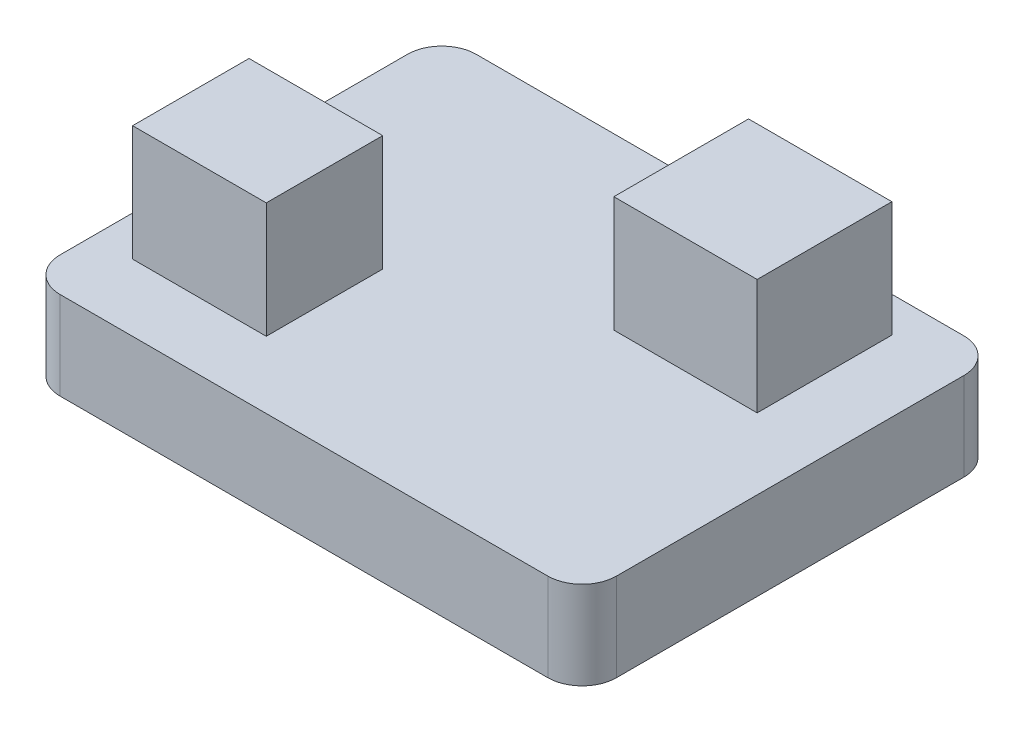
SolidWorks part; units mm, degrees
ref_plane "Front Plane" through (0, 0, 0) normal (0, 0, 1) x (1, 0, 0)
ref_plane "Top Plane" through (0, 0, 0) normal (0, 1, 0) x (1, 0, 0)
ref_plane "Right Plane" through (0, 0, 0) normal (1, 0, 0) x (0, 0, -1)
sketch "Sketch1" plane through (0, 0, 0) normal (0, 1, 0) x (1, 0, 0)
  line L1 (-102.7339, 76.8271) -> (102.7339, 76.8271)
  line L2 (-102.7339, 76.8271) -> (-102.7339, -76.8271)
  line L3 (-102.7339, -76.8271) -> (102.7339, -76.8271)
  line L4 (102.7339, 76.8271) -> (102.7339, -76.8271)
  line L5 (-102.7339, 76.8271) -> (102.7339, -76.8271) construction
  line L6 (-102.7339, -76.8271) -> (102.7339, 76.8271) construction
  point P0 (0, 0)
extrude "Extrude1" add sketch "Sketch1" along normal blind 32.512
sketch "Sketch2" plane through (0, 32.512, 0) normal (0, 1, 0) x (1, 0, 0)
  line L1 (-87.986, -9.1262) -> (-38.6203, -9.1262)
  line L2 (-87.986, -9.1262) -> (-87.986, -52.1292)
  line L3 (-87.986, -52.1292) -> (-38.6203, -52.1292)
  line L4 (-38.6203, -9.1262) -> (-38.6203, -52.1292)
  line L5 (-87.986, -9.1262) -> (-38.6203, -52.1292) construction
  line L6 (-87.986, -52.1292) -> (-38.6203, -9.1262) construction
  line L7 (23.5842, 63.7742) -> (76.5126, 63.7742)
  line L8 (23.5842, 63.7742) -> (23.5842, 14.0196)
  line L9 (23.5842, 14.0196) -> (76.5126, 14.0196)
  line L10 (76.5126, 63.7742) -> (76.5126, 14.0196)
  line L11 (23.5842, 63.7742) -> (76.5126, 14.0196) construction
  line L12 (23.5842, 14.0196) -> (76.5126, 63.7742) construction
  point P0 (-63.3032, -30.6277)
  point P5 (50.0484, 38.8969)
extrude "Extrude2" add sketch "Sketch2" along normal blind 42.672
fillet "Fillet1" radius 12.7 4 edges at (-102.7339, 16.256, -76.8271) (102.7339, 16.256, -76.8271) (102.7339, 16.256, 76.8271) (-102.7339, 16.256, 76.8271)
